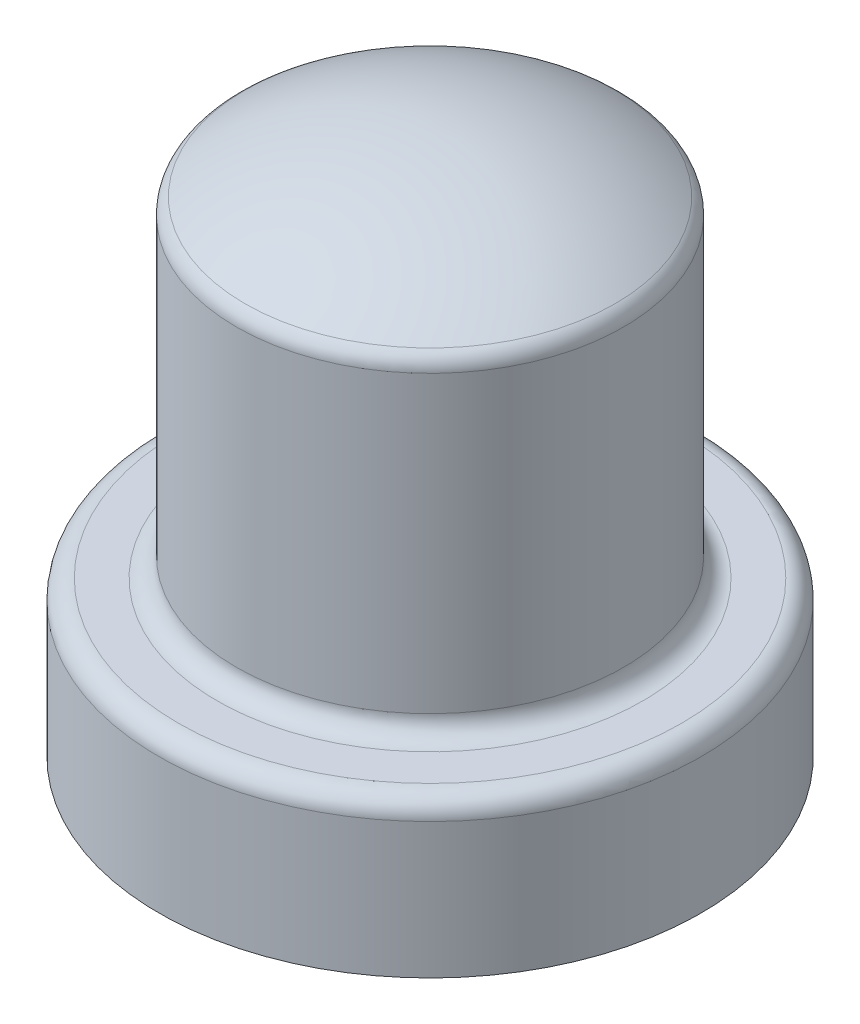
SolidWorks part; units mm, degrees
ref_plane "Plan de face" through (0, 0, 0) normal (0, 0, 1) x (1, 0, 0)
ref_plane "Plan de dessus" through (0, 0, 0) normal (0, 1, 0) x (1, 0, 0)
ref_plane "Plan de droite" through (0, 0, 0) normal (1, 0, 0) x (0, 0, -1)
sketch "Esquisse1" plane through (0, 0, 0) normal (0, 0, 1) x (1, 0, 0)
  line L0 (-6, 0) -> (-7, 0)
  line L1 (-6, 0) -> (-6, 3)
  line L2 (-6, 3) -> (-4, 3)
  line L3 (-7, 0) -> (-7, 3.5)
  line L4 (-4, 13) -> (-4, 3) construction
  line L5 (0, -12.2308) -> (0, 90.5787) construction
  line L6 (-4, 11.8443) -> (-4, 3)
  line L7 (-6.5, 4) -> (-5.5, 4)
  line L8 (-5, 12.1144) -> (-5, 4.5)
  line L9 (-5, 14) -> (-5, 4) construction
  line L10 (-4, 13) -> (0, 13) construction
  line L11 (-5, 14) -> (0, 14) construction
  line L12 (-7, 4) -> (-5, 4) construction
  line L13 (-7, 0) -> (-7, 4) construction
  line L14 (0, 13) -> (0, 14)
  arc A0 (0, 13) -> (-4, 11.8443) centre (0, 5.5) ccw
  arc A1 (0, 14) -> (-4.7812, 12.5278) centre (0, 5.5) ccw
  arc A2 (0, 14) -> (-4.5333, 12.6902) centre (0, 5.5) ccw construction
  arc A3 (-5, 4.5) -> (-5.5, 4) centre (-5.5, 4.5) cw
  arc A4 (-7, 3.5) -> (-6.5, 4) centre (-6.5, 3.5) cw
  arc A5 (-4.7812, 12.5278) -> (-5, 12.1144) centre (-4.5, 12.1144) ccw
  dimension "D1" = 1
  dimension "D3" = 1
  dimension "D6" = 15
  dimension "D7" = 0.5
  dimension "D2" = 12
  dimension "D4" = 3
  dimension "D5" = 8
  dimension "D8" = 10
revolve "Révolution1" add sketch "Esquisse1" angle 360 about L5
